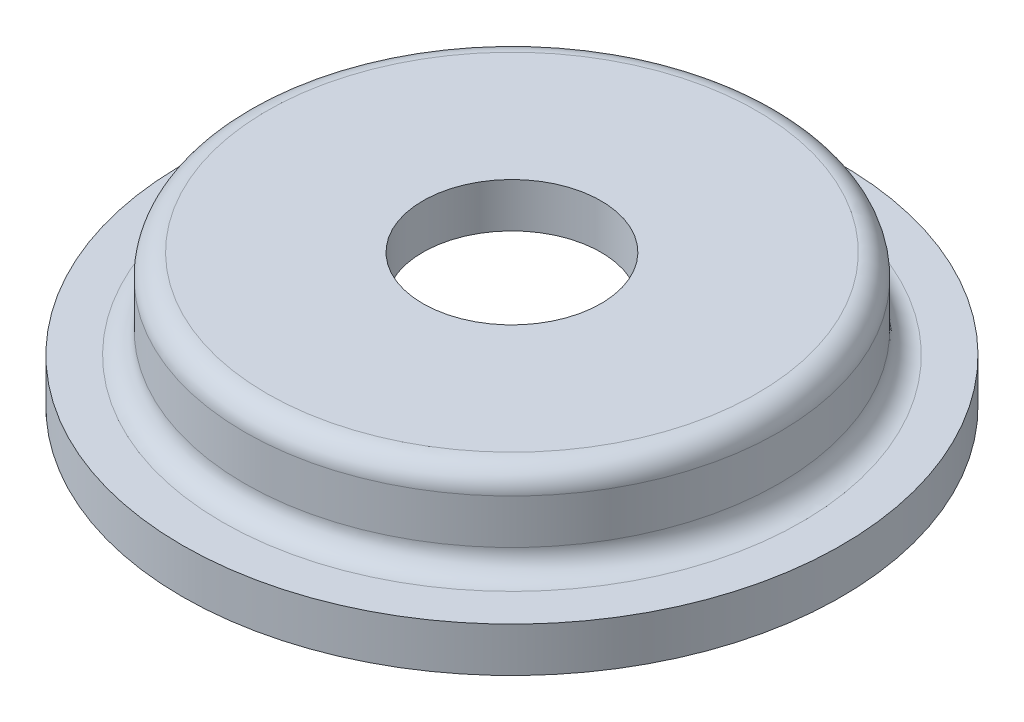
SolidWorks part; units mm, degrees
ref_plane "Plan de face" through (0, 0, 0) normal (0, 0, 1) x (1, 0, 0)
ref_plane "Plan de dessus" through (0, 0, 0) normal (0, 1, 0) x (1, 0, 0)
ref_plane "Plan de droite" through (0, 0, 0) normal (1, 0, 0) x (0, 0, -1)
sketch "Esquisse1" plane through (0, 0, 0) normal (0, 0, 1) x (1, 0, 0)
  line L0 (-7.4, 0) -> (-7.4, 1)
  line L1 (-7.4, 1) -> (-6.5, 1)
  line L2 (-6, 1.5) -> (-6, 2.5)
  line L3 (-5.5, 3) -> (-2, 3)
  line L4 (-2, 2) -> (-2, 3)
  line L5 (-7.4, 0) -> (-5.5, 0)
  line L6 (-5, 0.5) -> (-5, 1.5)
  line L7 (-4.5, 2) -> (-2, 2)
  line L8 (0, 7.1448) -> (0, -5.2411) construction
  arc A0 (-6, 2.5) -> (-5.5, 3) centre (-5.5, 2.5) cw
  arc A1 (-5, 1.5) -> (-4.5, 2) centre (-4.5, 1.5) cw
  arc A2 (-6.5, 1) -> (-6, 1.5) centre (-6.5, 1.5) ccw
  arc A3 (-5.5, 0) -> (-5, 0.5) centre (-5.5, 0.5) ccw
  point P14 (-6, 3)
  point P19 (-6, 1)
  dimension "D8" = 0.5
  dimension "D1" = 1
  dimension "D2" = 1
  dimension "D3" = 1
  dimension "D4" = 1.4
  dimension "D5" = 2
  dimension "D6" = 4
  dimension "D7" = 2
revolve "Révolution1" add sketch "Esquisse1" angle 360 about L8
